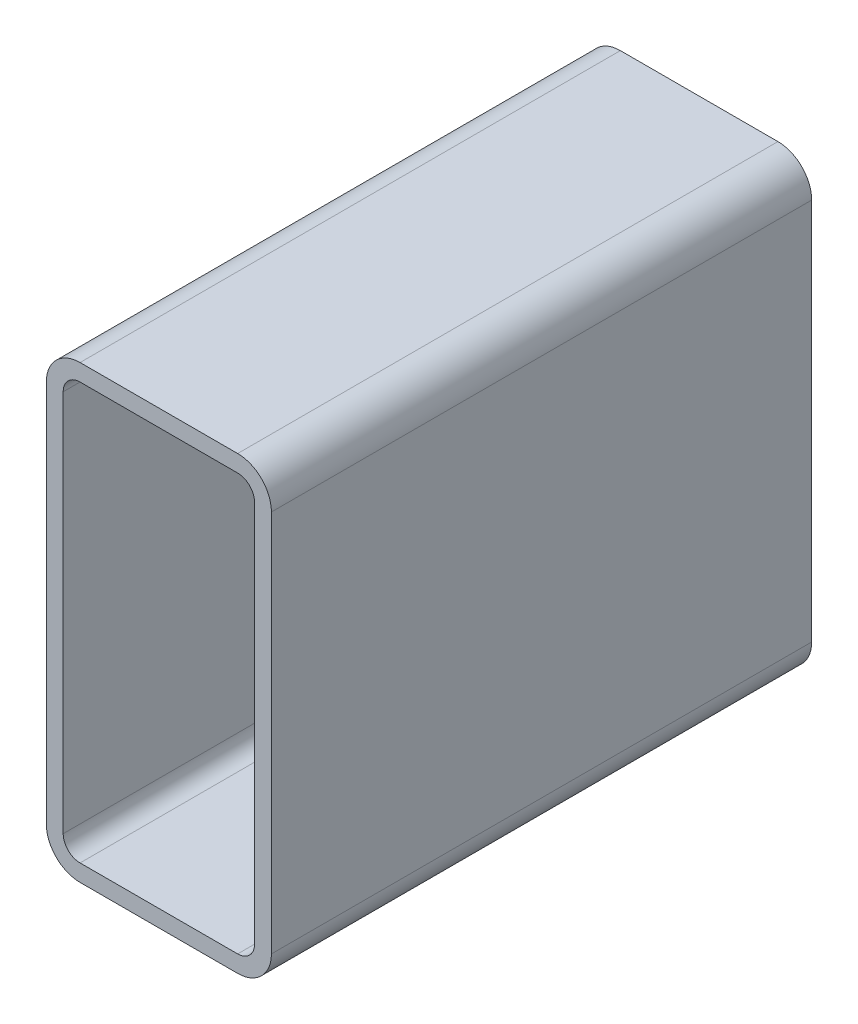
SolidWorks part; units mm, degrees
ref_plane "Front Plane" through (0, 0, 0) normal (0, 0, 1) x (1, 0, 0)
ref_plane "Top Plane" through (0, 0, 0) normal (0, 1, 0) x (1, 0, 0)
ref_plane "Right Plane" through (0, 0, 0) normal (1, 0, 0) x (0, 0, -1)
sketch "Sketch1" plane through (0, 0, 0) normal (0, 0, 1) x (1, 0, 0)
sketch_block_instance "HSS10x5x0.375-1"
sketch_block "HSS10x5x0.375"
extrude "Boss-Extrude1" add sketch "Sketch1" along normal blind 304.8
